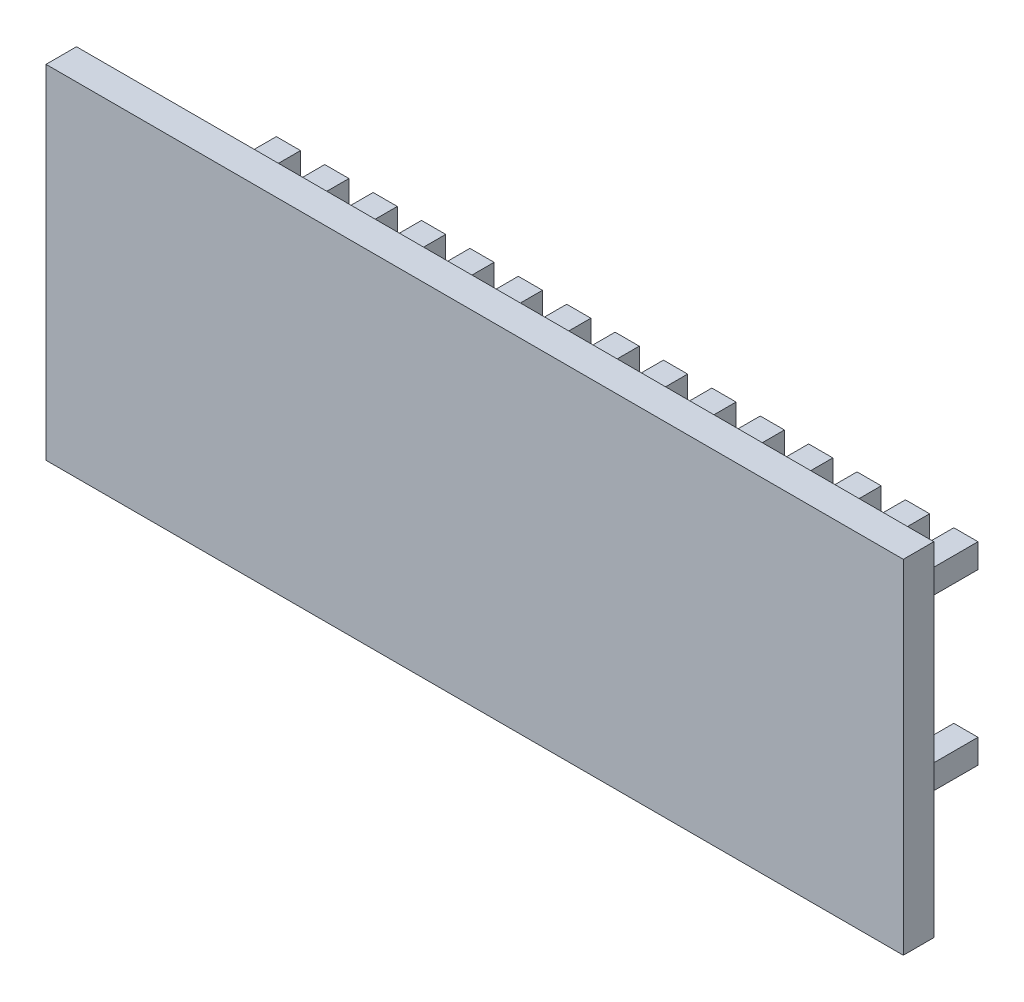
SolidWorks part; units mm, degrees
ref_plane "Front Plane" through (0, 0, 0) normal (0, 0, 1) x (1, 0, 0)
ref_plane "Top Plane" through (0, 0, 0) normal (0, 1, 0) x (1, 0, 0)
ref_plane "Right Plane" through (0, 0, 0) normal (1, 0, 0) x (0, 0, -1)
sketch "Sketch1" plane through (0, 0, 0) normal (0, 0, 1) x (1, 0, 0)
  line L1 (-22.5, 9) -> (22.5, 9)
  line L2 (-22.5, 9) -> (-22.5, -9)
  line L3 (-22.5, -9) -> (22.5, -9)
  line L4 (22.5, 9) -> (22.5, -9)
  line L5 (-22.5, 9) -> (22.5, -9) construction
  line L6 (-22.5, -9) -> (22.5, 9) construction
  point P0 (0, 0)
  dimension "D1" = 45
  dimension "D2" = 18
extrude "Boss-Extrude2" add sketch "Sketch1" along normal blind 1.6
sketch "Sketch2" plane through (0, 0, 0) normal (0, 0, -1) x (-1, 0, 0)
  line L0 (-22.5, -9) -> (-22.5, 9) construction
  line L5 (-19.74, 5.08) -> (-18.47, 5.08)
  line L6 (-19.74, 5.08) -> (-19.74, 3.81)
  line L7 (-19.74, 3.81) -> (-18.47, 3.81)
  line L8 (-18.47, 5.08) -> (-18.47, 3.81)
  line L9 (-17.2, 5.08) -> (-15.93, 5.08)
  line L10 (22.5, 0) -> (-22.5, 0) construction
  line L11 (-17.2, 3.81) -> (-15.93, 3.81)
  line L12 (-15.93, 5.08) -> (-15.93, 3.81)
  line L13 (-17.2, 5.08) -> (-17.2, 3.81)
  line L14 (-14.66, 5.08) -> (-13.39, 5.08)
  line L15 (-14.66, 3.81) -> (-13.39, 3.81)
  line L16 (-13.39, 5.08) -> (-13.39, 3.81)
  line L17 (-14.66, 5.08) -> (-14.66, 3.81)
  line L18 (-12.12, 5.08) -> (-10.85, 5.08)
  line L19 (-12.12, 3.81) -> (-10.85, 3.81)
  line L20 (-10.85, 5.08) -> (-10.85, 3.81)
  line L21 (-12.12, 5.08) -> (-12.12, 3.81)
  line L22 (-9.58, 5.08) -> (-8.31, 5.08)
  line L23 (-9.58, 3.81) -> (-8.31, 3.81)
  line L24 (-8.31, 5.08) -> (-8.31, 3.81)
  line L25 (-9.58, 5.08) -> (-9.58, 3.81)
  line L26 (-7.04, 5.08) -> (-5.77, 5.08)
  line L27 (-7.04, 3.81) -> (-5.77, 3.81)
  line L28 (-5.77, 5.08) -> (-5.77, 3.81)
  line L29 (-7.04, 5.08) -> (-7.04, 3.81)
  line L30 (-4.5, 5.08) -> (-3.23, 5.08)
  line L31 (-4.5, 3.81) -> (-3.23, 3.81)
  line L32 (-3.23, 5.08) -> (-3.23, 3.81)
  line L33 (-4.5, 5.08) -> (-4.5, 3.81)
  line L34 (-1.96, 5.08) -> (-0.69, 5.08)
  line L35 (-1.96, 3.81) -> (-0.69, 3.81)
  line L36 (-0.69, 5.08) -> (-0.69, 3.81)
  line L37 (-1.96, 5.08) -> (-1.96, 3.81)
  line L38 (0.58, 5.08) -> (1.85, 5.08)
  line L39 (0.58, 3.81) -> (1.85, 3.81)
  line L40 (1.85, 5.08) -> (1.85, 3.81)
  line L41 (0.58, 5.08) -> (0.58, 3.81)
  line L42 (3.12, 5.08) -> (4.39, 5.08)
  line L43 (3.12, 3.81) -> (4.39, 3.81)
  line L44 (4.39, 5.08) -> (4.39, 3.81)
  line L45 (3.12, 5.08) -> (3.12, 3.81)
  line L46 (5.66, 5.08) -> (6.93, 5.08)
  line L47 (5.66, 3.81) -> (6.93, 3.81)
  line L48 (6.93, 5.08) -> (6.93, 3.81)
  line L49 (5.66, 5.08) -> (5.66, 3.81)
  line L50 (8.2, 5.08) -> (9.47, 5.08)
  line L51 (8.2, 3.81) -> (9.47, 3.81)
  line L52 (9.47, 5.08) -> (9.47, 3.81)
  line L53 (8.2, 5.08) -> (8.2, 3.81)
  line L54 (10.74, 5.08) -> (12.01, 5.08)
  line L55 (10.74, 3.81) -> (12.01, 3.81)
  line L56 (12.01, 5.08) -> (12.01, 3.81)
  line L57 (10.74, 5.08) -> (10.74, 3.81)
  line L58 (13.28, 5.08) -> (14.55, 5.08)
  line L59 (13.28, 3.81) -> (14.55, 3.81)
  line L60 (14.55, 5.08) -> (14.55, 3.81)
  line L61 (13.28, 5.08) -> (13.28, 3.81)
  line L62 (15.82, 5.08) -> (17.09, 5.08)
  line L63 (15.82, 3.81) -> (17.09, 3.81)
  line L64 (17.09, 5.08) -> (17.09, 3.81)
  line L65 (15.82, 5.08) -> (15.82, 3.81)
  line L66 (15.82, -5.08) -> (15.82, -3.81)
  line L67 (17.09, -5.08) -> (17.09, -3.81)
  line L68 (15.82, -3.81) -> (17.09, -3.81)
  line L69 (15.82, -5.08) -> (17.09, -5.08)
  line L70 (13.28, -5.08) -> (13.28, -3.81)
  line L71 (14.55, -5.08) -> (14.55, -3.81)
  line L72 (13.28, -3.81) -> (14.55, -3.81)
  line L73 (13.28, -5.08) -> (14.55, -5.08)
  line L74 (10.74, -5.08) -> (10.74, -3.81)
  line L75 (12.01, -5.08) -> (12.01, -3.81)
  line L76 (10.74, -3.81) -> (12.01, -3.81)
  line L77 (10.74, -5.08) -> (12.01, -5.08)
  line L78 (8.2, -5.08) -> (8.2, -3.81)
  line L79 (9.47, -5.08) -> (9.47, -3.81)
  line L80 (8.2, -3.81) -> (9.47, -3.81)
  line L81 (8.2, -5.08) -> (9.47, -5.08)
  line L82 (5.66, -5.08) -> (5.66, -3.81)
  line L83 (6.93, -5.08) -> (6.93, -3.81)
  line L84 (5.66, -3.81) -> (6.93, -3.81)
  line L85 (5.66, -5.08) -> (6.93, -5.08)
  line L86 (3.12, -5.08) -> (3.12, -3.81)
  line L87 (4.39, -5.08) -> (4.39, -3.81)
  line L88 (3.12, -3.81) -> (4.39, -3.81)
  line L89 (3.12, -5.08) -> (4.39, -5.08)
  line L90 (0.58, -5.08) -> (0.58, -3.81)
  line L91 (1.85, -5.08) -> (1.85, -3.81)
  line L92 (0.58, -3.81) -> (1.85, -3.81)
  line L93 (0.58, -5.08) -> (1.85, -5.08)
  line L94 (-1.96, -5.08) -> (-1.96, -3.81)
  line L95 (-0.69, -5.08) -> (-0.69, -3.81)
  line L96 (-1.96, -3.81) -> (-0.69, -3.81)
  line L97 (-1.96, -5.08) -> (-0.69, -5.08)
  line L98 (-4.5, -5.08) -> (-4.5, -3.81)
  line L99 (-3.23, -5.08) -> (-3.23, -3.81)
  line L100 (-4.5, -3.81) -> (-3.23, -3.81)
  line L101 (-4.5, -5.08) -> (-3.23, -5.08)
  line L102 (-7.04, -5.08) -> (-7.04, -3.81)
  line L103 (-5.77, -5.08) -> (-5.77, -3.81)
  line L104 (-7.04, -3.81) -> (-5.77, -3.81)
  line L105 (-7.04, -5.08) -> (-5.77, -5.08)
  line L106 (-9.58, -5.08) -> (-9.58, -3.81)
  line L107 (-8.31, -5.08) -> (-8.31, -3.81)
  line L108 (-9.58, -3.81) -> (-8.31, -3.81)
  line L109 (-9.58, -5.08) -> (-8.31, -5.08)
  line L110 (-12.12, -5.08) -> (-12.12, -3.81)
  line L111 (-10.85, -5.08) -> (-10.85, -3.81)
  line L112 (-12.12, -3.81) -> (-10.85, -3.81)
  line L113 (-12.12, -5.08) -> (-10.85, -5.08)
  line L114 (-14.66, -5.08) -> (-14.66, -3.81)
  line L115 (-13.39, -5.08) -> (-13.39, -3.81)
  line L116 (-14.66, -3.81) -> (-13.39, -3.81)
  line L117 (-14.66, -5.08) -> (-13.39, -5.08)
  line L118 (-17.2, -5.08) -> (-17.2, -3.81)
  line L119 (-15.93, -5.08) -> (-15.93, -3.81)
  line L120 (-17.2, -3.81) -> (-15.93, -3.81)
  line L121 (-17.2, -5.08) -> (-15.93, -5.08)
  line L122 (-18.47, -5.08) -> (-18.47, -3.81)
  line L123 (-19.74, -3.81) -> (-18.47, -3.81)
  line L124 (-19.74, -5.08) -> (-19.74, -3.81)
  line L125 (-19.74, -5.08) -> (-18.47, -5.08)
  point P12 (0, 0)
  dimension "D1" = 1.27
  dimension "D2" = 1.27
  dimension "D3" = 2.76
  dimension "D4" = 3.81
  dimension "D5" = 15
extrude "Boss-Extrude3" add sketch "Sketch2" along normal blind 5.08
